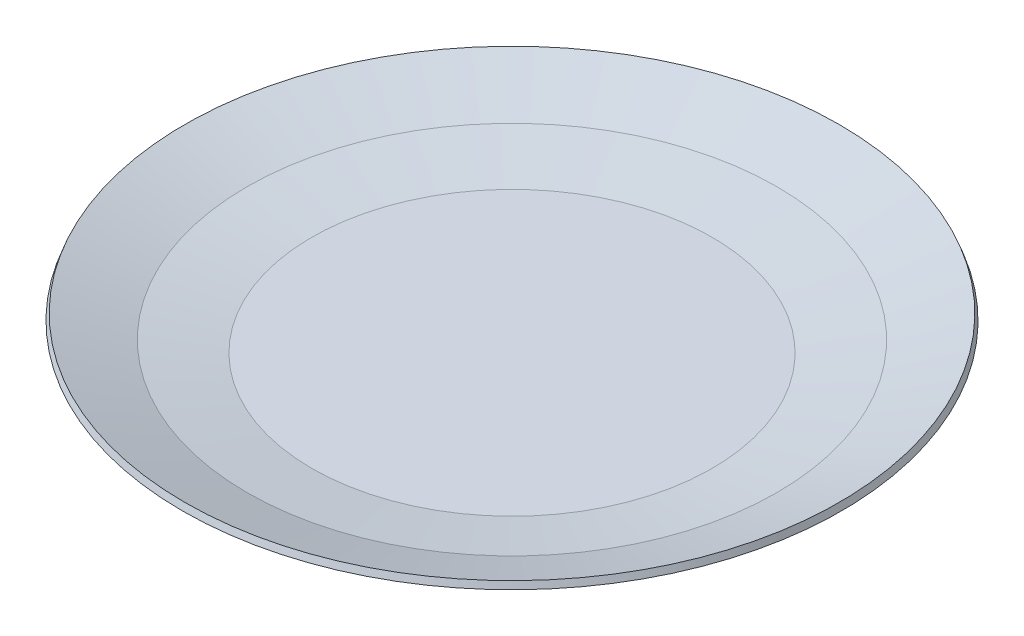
SolidWorks part; units mm, degrees
ref_plane "Front Plane" through (0, 0, 0) normal (0, 0, 1) x (1, 0, 0)
ref_plane "Top Plane" through (0, 0, 0) normal (0, 1, 0) x (1, 0, 0)
ref_plane "Right Plane" through (0, 0, 0) normal (1, 0, 0) x (0, 0, -1)
sketch "Sketch2" plane through (0, 0, 0) normal (0, 0, 1) x (1, 0, 0)
  line L0 (0, 0) -> (29.9125, 0)
  line L1 (0, 1) -> (29.9125, 1)
  line L2 (29.9125, 1) -> (39.5883, 2.7061)
  line L3 (39.5883, 2.7061) -> (48.903, 6.0964)
  line L4 (48.903, 6.0964) -> (49.245, 5.1567)
  line L5 (0, 1) -> (0, 0)
  line L6 (30.0862, 0.0152) -> (39.7619, 1.7213)
  line L7 (39.9303, 1.7664) -> (49.245, 5.1567)
  arc A0 (30.0862, 0.0152) -> (29.9125, 0) centre (29.9125, 1) cw
  arc A1 (39.9303, 1.7664) -> (39.7619, 1.7213) centre (39.5883, 2.7061) cw
  arc A2 (29.9125, 1) -> (29.9125, 1) centre (29.9125, 1) cw
  arc A3 (39.5883, 2.7061) -> (39.5883, 2.7061) centre (39.5883, 2.7061) cw
  point P4 (30, 0)
  point P8 (39.8481, 1.7365)
  dimension "D4" = 170
  dimension "D5" = 1
  dimension "D1" = 30
  dimension "D2" = 10
  dimension "D3" = 10
  dimension "D6" = 170
  dimension "D7" = 1
revolve "Revolve1" add sketch "Sketch2" angle 360 about L5
